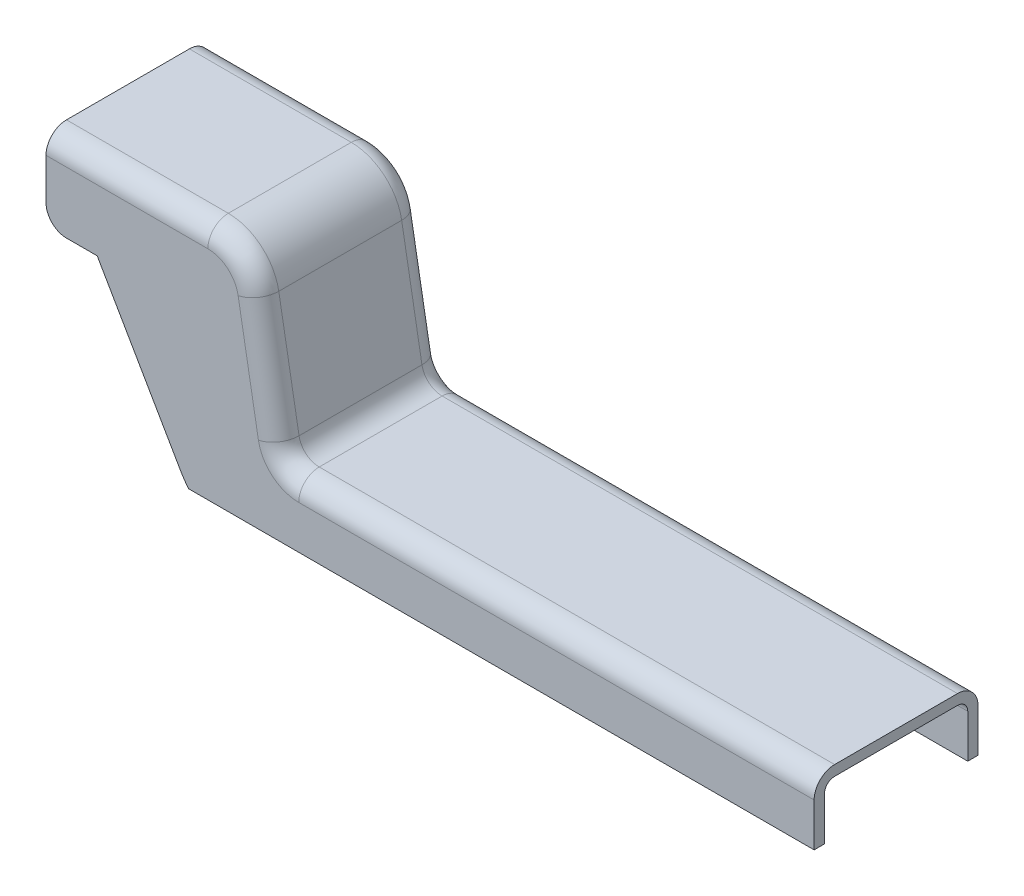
SolidWorks part; units mm, degrees
ref_plane "Vorne" through (0, 0, 0) normal (0, 0, 1) x (1, 0, 0)
ref_plane "Oben" through (0, 0, 0) normal (0, 1, 0) x (1, 0, 0)
ref_plane "Rechts" through (0, 0, 0) normal (1, 0, 0) x (0, 0, -1)
sketch "Skizze1" plane through (0, 0, 0) normal (0, 0, 1) x (1, 0, 0)
  line L0 (-2.8868, 5) -> (-10.9776, 19.0138)
  line L1 (-10.9776, 19.0138) -> (-13.9776, 19.0138)
  line L2 (-15.9776, 21.0138) -> (-15.9776, 27.0138)
  line L3 (-15.9776, 27.0138) -> (-0.1731, 27.0138)
  line L4 (4.7509, 22.8821) -> (7.0224, 10)
  line L5 (7.0224, 10) -> (59.0224, 10)
  line L6 (59.0224, 10) -> (59.0224, 0)
  line L7 (59.0224, 0) -> (5.7735, 0)
  arc A0 (-0.1731, 27.0138) -> (4.7509, 22.8821) centre (-0.1731, 22.0138) cw
  arc A1 (-2.8868, 5) -> (5.7735, 0) centre (5.7735, 10) ccw
  arc A2 (-13.9776, 19.0138) -> (-15.9776, 21.0138) centre (-13.9776, 21.0138) cw
  point P11 (4.0224, 27.0138)
  point P14 (0, 0)
  point P17 (-15.9776, 19.0138)
  dimension "D9" = 5
  dimension "D10" = 10
  dimension "D11" = 2
  dimension "D1" = 10
  dimension "D2" = 20
  dimension "D3" = 52
  dimension "D4" = 80
  dimension "D5" = 60
  dimension "D6" = 5
  dimension "D7" = 75
  dimension "D8" = 8
extrude "Linear austragen1" add sketch "Skizze1" along normal blind 16
fillet "Verrundung1" radius 2 9 edges at (5.8866, 16.441, 16) (3.0408, 25.8441, 16) (5.8866, 16.441, 0) (3.0408, 25.8441, 0) (33.0224, 10, 16) (7.0224, 10, 8) (33.0224, 10, 0) (-8.0754, 27.0138, 16) (-8.0754, 27.0138, 0)
shell "Wandung1" thickness 1
sketch "Skizze2" plane through (0, 0, 16) normal (0, 0, 1) x (1, 0, 0)
  line L0 (-0.1731, 27.0138) -> (-15.9776, 27.0138) construction
  line L1 (-15.9776, 27.0138) -> (-0.1731, 27.0138) construction
  circle A0 centre (-13.9776, 23.5138) radius 1
  circle A1 centre (-4.9776, 16.5138) radius 1
  dimension "D3" = 2
  dimension "D4" = 2
  dimension "D1" = 9
  dimension "D2" = 10.5
  dimension "D5" = 3.5
extrude "Linear austragen2" add sketch "Skizze2" against normal up to surface (16 mm away)
sketch "Skizze3" plane through (0, 0, 0) normal (0, -1, 0) x (1, 0, 0)
  line L0 (59.0224, 16) -> (59.0224, 0) construction
  line L1 (5.7735, 0) -> (59.0224, 0) construction
  circle A0 centre (19.0224, 8) radius 4
  circle A1 centre (44.0224, 8) radius 4
  dimension "D1" = 8
  dimension "D2" = 8
  dimension "D3" = 25
  dimension "D4" = 15
  dimension "D5" = 8
extrude "Linear austragen3" add sketch "Skizze3" along normal blind 3
chamfer "Fase1" distance 1 angle 45 2 edges at (23.0224, -3, 8) (48.0224, -3, 8)
sketch "Skizze4" plane through (0, 0, 16) normal (0, 0, 1) x (1, 0, 0)
  line L0 (16.0224, -3) -> (22.0224, -3) construction
  line L1 (-2.1824, 3.78) -> (59.0224, 3.78)
  line L2 (-2.1824, 3.78) -> (-2.1824, -3)
  line L3 (-2.1824, -3) -> (59.0224, -3)
  line L4 (59.0224, 3.78) -> (59.0224, -3)
  line L5 (59.0224, 0) -> (59.0224, 8) construction
  line L6 (-10.9776, 19.0138) -> (-2.8868, 5) construction
  line L7 (8.7006, 10) -> (59.0224, 10) construction
  dimension "D1" = 6.22
extrude "Schnitt-Linear austragen1" cut sketch "Skizze4" against normal through all
